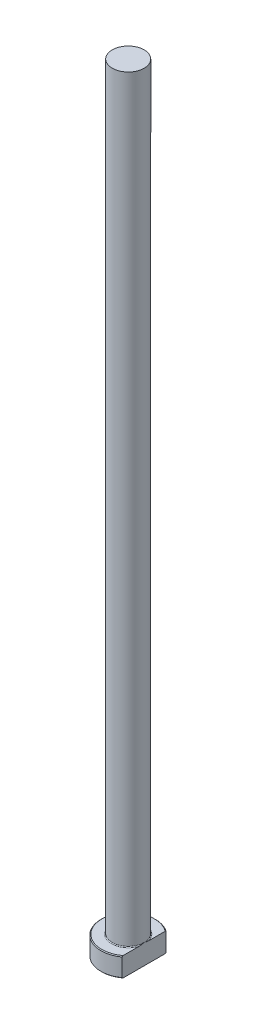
SolidWorks part; units mm, degrees
ref_plane "Front Plane" through (0, 0, 0) normal (0, 0, 1) x (1, 0, 0)
ref_plane "Top Plane" through (0, 0, 0) normal (0, 1, 0) x (1, 0, 0)
ref_plane "Right Plane" through (0, 0, 0) normal (1, 0, 0) x (0, 0, -1)
sketch "Sketch1" plane through (0, 0, 0) normal (0, 0, 1) x (1, 0, 0)
  line L0 (0, 259.9588) -> (0, -15.1925) construction
  line L1 (0, 0) -> (-7, 0)
  line L2 (-7, 0) -> (-7, 5)
  line L3 (-7, 5) -> (-4.1, 5)
  line L4 (-4.1, 5) -> (-4.1, 200)
  line L5 (-4.1, 200) -> (0, 200)
  line L6 (0, 200) -> (0, 0)
  dimension "L" = 200
  dimension "H" = 14
  dimension "T" = 5
  dimension "D" = 8.2
revolve "Revolve1" add sketch "Sketch1" angle 360 about L0
chamfer "Chamfer1" distance 0.2 angle 45 2 edges at (0, 5, 7) (0, 0, 7)
fillet "Fillet1" radius 0.2 1 edges at (0, 5, 4.1)
sketch "Sketch2" plane through (0, 0, 0) normal (0, 1, 0) x (1, 0, 0)
  line L0 (4.1, 5.6736) -> (4.1, -5.6736)
  circle A0 centre (0, 0) radius 7 construction
  arc A1 (4.1, -5.6736) -> (4.1, 5.6736) centre (0, 0) ccw
  circle A2 centre (0, 0) radius 4.1 construction
extrude "KEY" cut sketch "Sketch2" along normal through all
